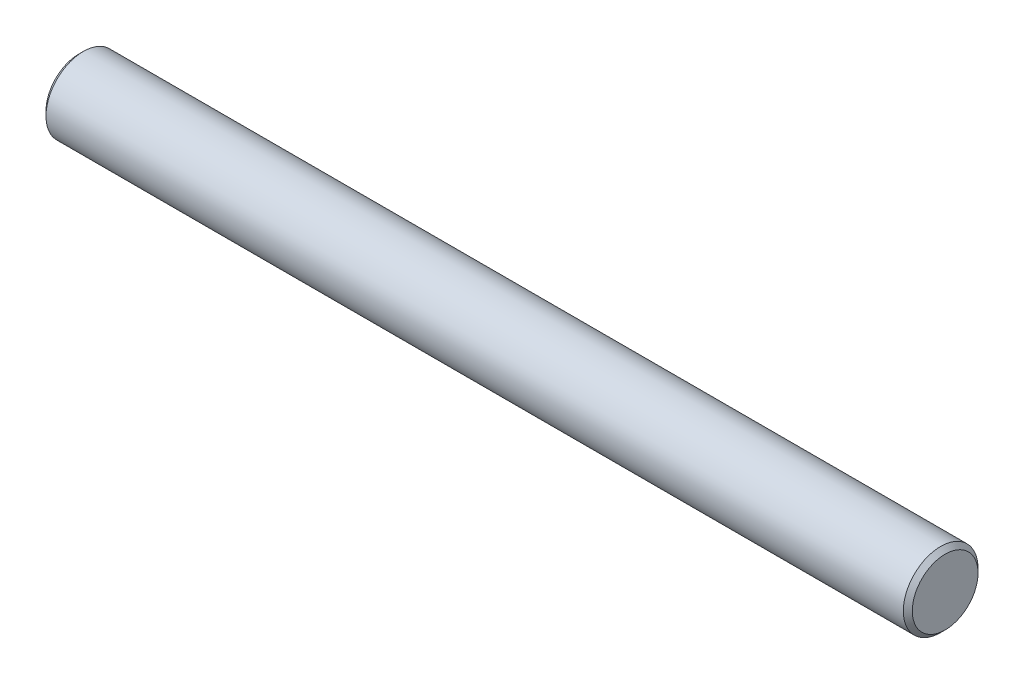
SolidWorks part; units mm, degrees
ref_plane "Plan de face" through (0, 0, 0) normal (0, 0, 1) x (1, 0, 0)
ref_plane "Plan de dessus" through (0, 0, 0) normal (0, 1, 0) x (1, 0, 0)
ref_plane "Plan de droite" through (0, 0, 0) normal (1, 0, 0) x (0, 0, -1)
sketch "Esquisse1" plane through (0, 0, 0) normal (1, 0, 0) x (0, 0, -1)
  circle A0 centre (0, 0) radius 2.5
  dimension "D1" = 5
extrude "Boss.-Extru.1" add sketch "Esquisse1" along normal mid plane 58
chamfer "Chanfrein1" distance 0.3 angle 45 2 edges at (-29, 0, -2.5) (29, 0, -2.5)
